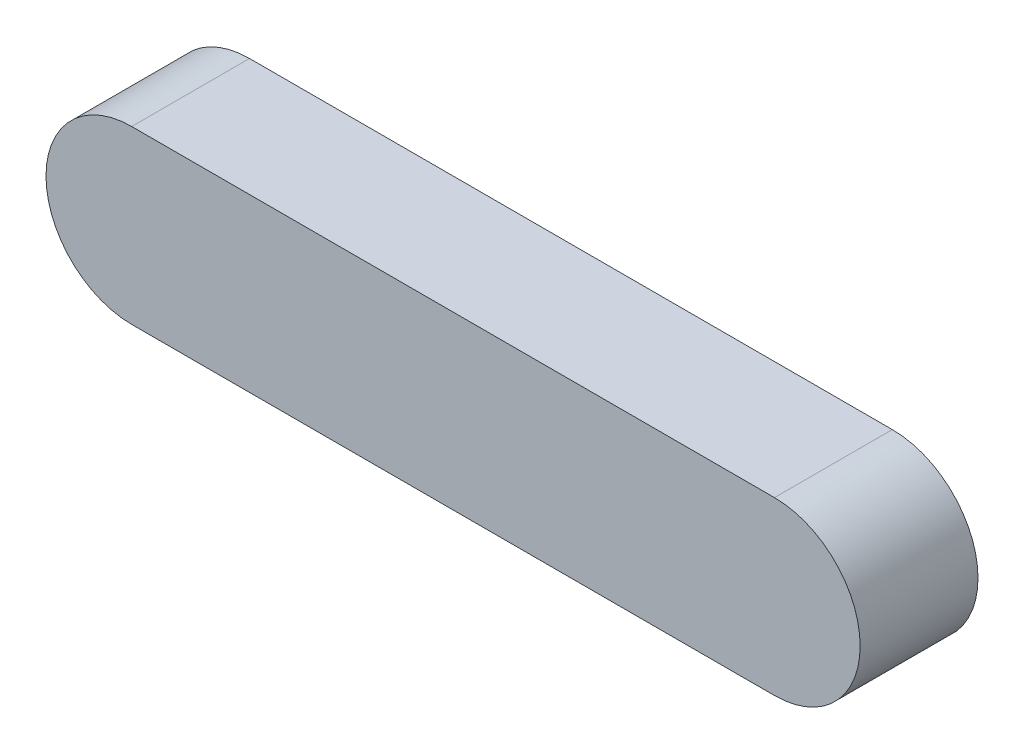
SolidWorks part; units mm, degrees
ref_plane "Plan1" through (0, 0, 0) normal (0, 0, 1) x (1, 0, 0)
ref_plane "Plan2" through (0, 0, 0) normal (0, 1, 0) x (1, 0, 0)
ref_plane "Plan3" through (0, 0, 0) normal (1, 0, 0) x (0, 0, -1)
sketch "Esquisse1" plane through (0, 0, 0) normal (0, 0, 1) x (1, 0, 0)
  line L0 (-60, 58) -> (-30, 58)
  line L1 (-60, 50) -> (-30, 50)
  arc A0 (-30, 58) -> (-30, 50) centre (-30, 54) cw
  arc A1 (-60, 58) -> (-60, 50) centre (-60, 54) ccw
  dimension "D1" = 4
  dimension "D2" = 30
extrude "Base-Extrusion" add sketch "Esquisse1" along normal blind 5.5
